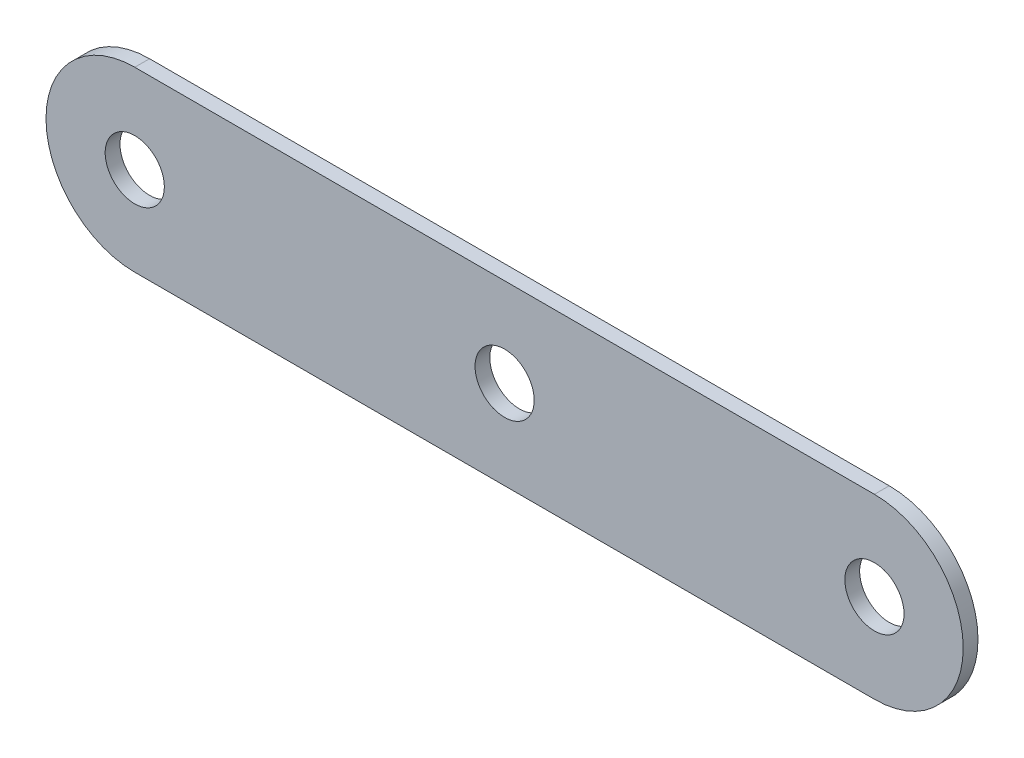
SolidWorks part; units mm, degrees
ref_plane "Front Plane" through (0, 0, 0) normal (0, 0, 1) x (1, 0, 0)
ref_plane "Top Plane" through (0, 0, 0) normal (0, 1, 0) x (1, 0, 0)
ref_plane "Right Plane" through (0, 0, 0) normal (1, 0, 0) x (0, 0, -1)
sketch "Sketch2" plane through (0, 0, 0) normal (0, 0, 1) x (1, 0, 0)
  line L1 (250, -60) -> (-250, -60)
  line L3 (250, 60) -> (-250, 60)
  line L5 (250, -60) -> (-250, 60) construction
  line L6 (250, 60) -> (-250, -60) construction
  arc A0 (-250, 60) -> (-250, -60) centre (-250, 0) ccw
  arc A1 (250, 60) -> (250, -60) centre (250, 0) cw
  circle A2 centre (-250, 0) radius 20
  circle A3 centre (0, 0) radius 20
  circle A4 centre (250, 0) radius 20
  point P0 (0, 0)
  point P12 (0, 0)
  dimension "D1" = 40
  dimension "D3" = 60
  dimension "D2" = 500
extrude "Boss-Extrude1" add sketch "Sketch2" along normal mid plane 10
